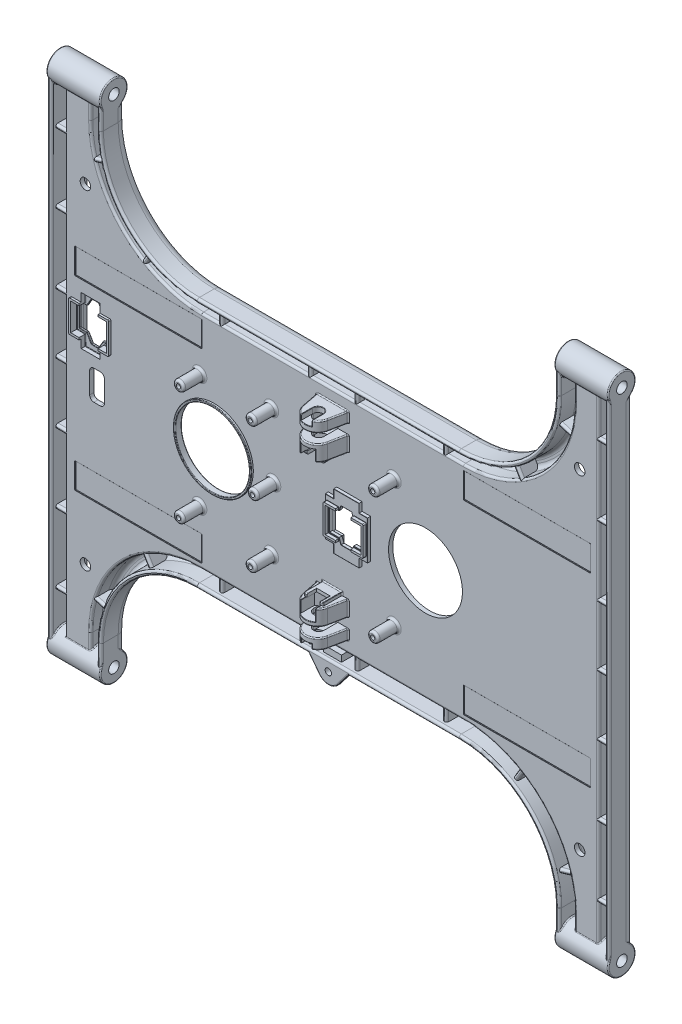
SolidWorks part; units mm, degrees
ref_plane "Face" through (0, 0, 0) normal (0, 0, 1) x (1, 0, 0)
ref_plane "Dessus" through (0, 0, 0) normal (0, 1, 0) x (1, 0, 0)
ref_plane "Droite" through (0, 0, 0) normal (1, 0, 0) x (0, 0, -1)
sketch "Esquisse1" plane through (0, 0, 0) normal (0, 0, 1) x (1, 0, 0)
  line L0 (0, 0) -> (0, 93.6129) construction
  line L1 (0, 55) -> (-62, 55)
  line L2 (0, 55) -> (62, 55)
  line L3 (-62, 55) -> (-62, 105) construction
  line L4 (62, 55) -> (62, 105) construction
  line L5 (-62, 105) -> (-112, 105) construction
  line L6 (62, 105) -> (112, 105) construction
  arc A0 (-112, 105) -> (-62, 55) centre (-62, 105) ccw
  arc A1 (112, 105) -> (62, 55) centre (62, 105) cw
  dimension "D1" = 55
  dimension "D2" = 112
  dimension "D3" = 62
ref_plane "Plan1" through (0, 105, 0) normal (0, 1, 0) x (-1, 0, 0)
sketch "Esquisse2" plane through (0, 105, 0) normal (0, 1, 0) x (-1, 0, 0)
  line L0 (-116.5, 0) -> (-116.5, -6)
  line L1 (-112.5, -10) -> (-111.5, -10)
  line L2 (-107.5, -6) -> (-107.5, 2)
  line L5 (-116.5, 0) -> (-114.5, 0)
  line L6 (-114.5, 0) -> (-114.5, -6)
  line L7 (-112.5, -8) -> (-111.5, -8)
  line L8 (-109.5, -6) -> (-109.5, 2)
  line L9 (-109.5, 2) -> (-107.5, 2)
  line L10 (-112, -8) -> (-112, 7.5979) construction
  line L11 (-62, 0) -> (-112, 0) construction
  arc A0 (-114.5, -6) -> (-112.5, -8) centre (-112.5, -6) ccw
  arc A1 (-109.5, -6) -> (-111.5, -8) centre (-111.5, -6) cw
  arc A2 (-112.5, -10) -> (-116.5, -6) centre (-112.5, -6) cw
  arc A3 (-107.5, -6) -> (-111.5, -10) centre (-111.5, -6) cw
  point P18 (-116.5, -10)
  point P21 (-107.5, -10)
  dimension "D7" = 2
  dimension "D8" = 4
  dimension "D1" = 2
  dimension "D2" = 10
  dimension "D3" = 9
  dimension "D4" = 2
  dimension "D5" = 2
  dimension "D6" = 2
sweep "Balayage1" add profiles "Esquisse2" path "Esquisse1"
sketch "Esquisse3" plane through (0, 0, 0) normal (0, 0, 1) x (1, 0, 0)
  line L0 (62, 50.5) -> (-62, 50.5) construction
  line L1 (62, 50.5) -> (-62, 50.5)
  line L2 (-116.5, 105) -> (-124, 105)
  line L3 (12.925, 105) -> (-12.925, 105) construction
  line L4 (-124, 105) -> (-124, 0)
  line L5 (-124, 0) -> (124, 0)
  line L6 (124, 0) -> (124, 105)
  line L7 (116.5, 105) -> (124, 105)
  arc A0 (-116.5, 105) -> (-62, 50.5) centre (-62, 105) ccw construction
  arc A1 (62, 50.5) -> (116.5, 105) centre (62, 105) ccw construction
  arc A2 (-116.5, 105) -> (-62, 50.5) centre (-62, 105) ccw
  arc A3 (62, 50.5) -> (116.5, 105) centre (62, 105) ccw
  dimension "D1" = 124
  dimension "D2" = 124
extrude "Extrusion1" add sketch "Esquisse3" against normal blind 2
mirror "Symétrie3" about plane through (0, 0, 0) normal (0, 1, 0) of "Extrusion1"
mirror "Symétrie4" about plane through (0, 0, 0) normal (0, 1, 0) of "Balayage1"
sketch "Esquisse4" plane through (0, 0, 0) normal (0, 1, 0) x (1, 0, 0)
  line L0 (133, -2) -> (133, 6)
  line L1 (129, 10) -> (128, 10)
  line L2 (124, 6) -> (124, 0)
  line L3 (124, 0) -> (126, 0)
  line L4 (126, 0) -> (126, 6)
  line L5 (128, 8) -> (129, 8)
  line L6 (131, 6) -> (131, -2)
  line L7 (131, -2) -> (133, -2)
  line L8 (114.5, 0) -> (124, 0) construction
  line L9 (124, 2) -> (124, 0) construction
  arc A0 (126, 6) -> (128, 8) centre (128, 6) cw
  arc A1 (131, 6) -> (129, 8) centre (129, 6) ccw
  arc A2 (124, 6) -> (128, 10) centre (128, 6) cw
  arc A3 (133, 6) -> (129, 10) centre (129, 6) ccw
  point P16 (124, 10)
  point P19 (133, 10)
  dimension "D7" = 2
  dimension "D8" = 4
  dimension "D1" = 2
  dimension "D2" = 2
  dimension "D3" = 2
  dimension "D4" = 10
  dimension "D5" = 12
  dimension "D6" = 9
extrude "Extrusion2" add sketch "Esquisse4" along normal mid plane 210
mirror "Symétrie5" about plane through (0, 0, 0) normal (1, 0, 0) of "Extrusion2"
sketch "Esquisse6" plane through (0, 105, 0) normal (0, 1, 0) x (-1, 0, 0)
  line L0 (0, 0) -> (0, -121.7438) construction
  line L1 (114.5, -6) -> (114.5, 0)
  line L2 (111.5, -8) -> (112.5, -8)
  line L3 (109.5, 2) -> (109.5, -6)
  line L4 (107.5, 2) -> (109.5, 2)
  line L5 (107.5, -6) -> (107.5, 2)
  line L6 (112.5, -10) -> (111.5, -10)
  line L7 (116.5, -2) -> (116.5, -6)
  line L8 (124, -2) -> (116.5, -2)
  line L9 (124, -6) -> (124, -2)
  line L10 (129, -10) -> (128, -10)
  line L11 (133, 2) -> (133, -6)
  line L12 (131, 2) -> (133, 2)
  line L13 (131, -6) -> (131, 2)
  line L14 (128, -8) -> (129, -8)
  line L15 (126, 0) -> (126, -6)
  line L16 (-114.5, 0) -> (-126, 0)
  line L17 (-126, 0) -> (-126, -6)
  line L18 (-128, -8) -> (-129, -8)
  line L19 (-131, -6) -> (-131, 2)
  line L20 (-131, 2) -> (-133, 2)
  line L21 (-133, 2) -> (-133, -6)
  line L22 (-129, -10) -> (-128, -10)
  line L23 (-124, -6) -> (-124, -2)
  line L24 (-124, -2) -> (-116.5, -2)
  line L25 (-116.5, -2) -> (-116.5, -6)
  line L26 (-112.5, -10) -> (-111.5, -10)
  line L27 (-107.5, -6) -> (-107.5, 2)
  line L28 (-107.5, 2) -> (-109.5, 2)
  line L29 (-109.5, 2) -> (-109.5, -6)
  line L30 (-111.5, -8) -> (-112.5, -8)
  line L31 (-114.5, -6) -> (-114.5, 0)
  line L32 (-114.5, 0) -> (-126, 0)
  line L33 (-126, 0) -> (-126, -6)
  line L34 (-128, -8) -> (-129, -8)
  line L35 (-131, -6) -> (-131, 2)
  line L36 (-131, 2) -> (-133, 2)
  line L37 (-133, 2) -> (-133, -6)
  line L38 (-129, -10) -> (-128, -10)
  line L39 (-124, -6) -> (-124, -2)
  line L40 (-124, -2) -> (-116.5, -2)
  line L41 (-116.5, -2) -> (-116.5, -6)
  line L42 (-112.5, -10) -> (-111.5, -10)
  line L43 (-107.5, -6) -> (-107.5, 2)
  line L44 (-107.5, 2) -> (-109.5, 2)
  line L45 (-109.5, 2) -> (-109.5, -6)
  line L46 (-111.5, -8) -> (-112.5, -8)
  line L47 (-114.5, -6) -> (-114.5, 0)
  line L48 (114.5, 0) -> (126, 0)
  arc A0 (114.5, -6) -> (112.5, -8) centre (112.5, -6) cw
  arc A1 (111.5, -8) -> (109.5, -6) centre (111.5, -6) cw
  arc A2 (111.5, -10) -> (107.5, -6) centre (111.5, -6) cw
  arc A3 (116.5, -6) -> (112.5, -10) centre (112.5, -6) cw
  arc A4 (128, -10) -> (124, -6) centre (128, -6) cw
  arc A5 (133, -6) -> (129, -10) centre (129, -6) cw
  arc A6 (131, -6) -> (129, -8) centre (129, -6) cw
  arc A7 (128, -8) -> (126, -6) centre (128, -6) cw
  arc A8 (-128, -8) -> (-126, -6) centre (-128, -6) ccw
  arc A9 (-131, -6) -> (-129, -8) centre (-129, -6) ccw
  arc A10 (-133, -6) -> (-129, -10) centre (-129, -6) ccw
  arc A11 (-128, -10) -> (-124, -6) centre (-128, -6) ccw
  arc A12 (-116.5, -6) -> (-112.5, -10) centre (-112.5, -6) ccw
  arc A13 (-111.5, -10) -> (-107.5, -6) centre (-111.5, -6) ccw
  arc A14 (-111.5, -8) -> (-109.5, -6) centre (-111.5, -6) ccw
  arc A15 (-114.5, -6) -> (-112.5, -8) centre (-112.5, -6) ccw
  arc A16 (-128, -8) -> (-126, -6) centre (-128, -6) ccw
  arc A17 (-131, -6) -> (-129, -8) centre (-129, -6) ccw
  arc A18 (-133, -6) -> (-129, -10) centre (-129, -6) ccw
  arc A19 (-128, -10) -> (-124, -6) centre (-128, -6) ccw
  arc A20 (-116.5, -6) -> (-112.5, -10) centre (-112.5, -6) ccw
  arc A21 (-111.5, -10) -> (-107.5, -6) centre (-111.5, -6) ccw
  arc A22 (-111.5, -8) -> (-109.5, -6) centre (-111.5, -6) ccw
  arc A23 (-114.5, -6) -> (-112.5, -8) centre (-112.5, -6) ccw
  dimension "D1" = 0
extrude "Extrusion3" add sketch "Esquisse6" along normal blind 10
mirror "Symétrie6" about plane through (0, 0, 0) normal (0, 1, 0) of "Extrusion3"
sketch "Esquisse5" plane through (133, 0, 0) normal (1, 0, 0) x (0, 0, -1)
  line L0 (0, 115) -> (0, -115) construction
  circle A0 centre (4, 117.5) radius 6.5
  dimension "D3" = 13
  dimension "D1" = 117.5
  dimension "D2" = 4
extrude "Extrusion4" add sketch "Esquisse5" against normal up to surface (25.5 mm away)
sketch "Esquisse7" plane through (133, 0, 0) normal (1, 0, 0) x (0, 0, -1)
  circle A0 centre (4, 117.5) radius 2.5
  dimension "D1" = 5
extrude "Enlèv. mat.-Extru.1" cut sketch "Esquisse7" against normal blind 40
mirror "Symétrie8" about plane through (0, 0, 0) normal (0, 1, 0) of "Enlèv. mat.-Extru.1", "Extrusion4"
sketch "Esquisse8" plane through (-133, 0, 0) normal (-1, 0, 0) x (0, 0, 1)
  circle A0 centre (-4, 117.5) radius 6.5
  circle A1 centre (-4, -117.5) radius 6.5
extrude "Extrusion5" add sketch "Esquisse8" against normal up to surface (25.5 mm away)
sketch "Esquisse9" plane through (-133, 0, 0) normal (-1, 0, 0) x (0, 0, 1)
  circle A0 centre (-4, 117.5) radius 2.5 construction
  circle A1 centre (-4, 117.5) radius 2.5
  circle A2 centre (-4, -117.5) radius 2.5 construction
  circle A3 centre (-4, -117.5) radius 2.5
extrude "Enlèv. mat.-Extru.2" cut sketch "Esquisse9" against normal blind 40
sketch "Esquisse10" plane through (0, 0, 0) normal (0, 0, 1) x (1, 0, 0)
  line L0 (-29, 30) -> (29, 30) construction
  line L1 (0, 0) -> (67.6607, 0) construction
  circle A0 centre (-63, 27) radius 2.5
  circle A1 centre (-29, 30) radius 2.5
  circle A2 centre (29, 30) radius 2.5
  circle A3 centre (29, -30) radius 2.5
  circle A4 centre (-29, -30) radius 2.5
  circle A5 centre (-63, -27) radius 2.5
  circle A6 centre (-28, 0) radius 2.5
  dimension "D2" = 5
  dimension "D3" = 5
  dimension "D4" = 5
  dimension "D9" = 5
  dimension "D1" = 30
  dimension "D5" = 58
  dimension "D6" = 27
  dimension "D7" = 34
  dimension "D8" = 29
  dimension "D10" = 35
extrude "Extrusion6" add sketch "Esquisse10" along normal blind 10
sketch "Esquisse11" plane through (0, 0, 10) normal (0, 0, 1) x (1, 0, 0)
  line L0 (0, 0) -> (51.2219, 0) construction
  circle A8 centre (-63, 27) radius 1
  circle A9 centre (-29, 30) radius 1
  circle A10 centre (29, 30) radius 1
  circle A11 centre (29, -30) radius 1
  circle A12 centre (-29, -30) radius 1
  circle A13 centre (-63, -27) radius 1
  circle A14 centre (-28, 0) radius 1
  dimension "D1" = 2
extrude "Enlèv. mat.-Extru.3" cut sketch "Esquisse11" against normal blind 8
fillet "Congé1" radius 1 14 edges at (-60.5, 27, 0) (-60.5, 27, 10) (-26.5, 30, 0) (-26.5, 30, 10) (31.5, 30, 0) (31.5, 30, 10) (26.5, -30, 0) (26.5, -30, 10) (-31.5, -30, 0) (-31.5, -30, 10) (-65.5, -27, 0) (-65.5, -27, 10) (-25.5, 0, 0) (-25.5, 0, 10)
sketch "Esquisse12" plane through (0, 0, 0) normal (0, 0, 1) x (1, 0, 0)
  line L0 (0, 0) -> (-92.224, 0) construction
  line L1 (-63, 27) -> (-63, -16.4921) construction
  circle A0 centre (-56, 0) radius 17.5
  dimension "D2" = 35
  dimension "D1" = 7
extrude "Enlèv. mat.-Extru.4" cut sketch "Esquisse12" against normal blind 8
sketch "Esquisse13" plane through (0, 0, 0) normal (0, 0, 1) x (1, 0, 0)
  circle A0 centre (-56, 0) radius 17.5 construction
  circle A1 centre (-56, 0) radius 17.5
  circle A2 centre (-56, 0) radius 18.5
  dimension "D1" = 1
extrude "Extrusion7" add sketch "Esquisse13" along normal blind 1
fillet "Congé2" radius 0.25 3 edges at (-38.5, 0, 1) (-37.5, 0, 1) (-38.5, 0, -2)
fillet "Congé3" radius 1 43 edges at (-94.1734, -72.8266, 2) (99.1231, 67.8769, 0) (-99.1231, -67.8769, 0) (0, -59.5, 2) (0, -52.5, 0) (99.1231, -67.8769, 0) (95.5876, -71.4124, 2) (94.1734, -72.8266, 2) (0, -57.5, 2) (-95.5876, -71.4124, 2) (95.5876, 71.4124, 2) (94.1734, 72.8266, 2) (131, 0, 2) (133, 0, 2) (-133, 0, 2) (-131, 0, 2) (107.5, 110, 2) (109.5, 110, 2) (132, 115, 2) (108.5, 115, 2) (-109.5, 110, 2) (-107.5, 110, 2) (-108.5, 115, 2) (-132, 115, 2) (0, 59.5, 2) (0, 57.5, 2) (0, 52.5, 0) (108.5, -115, 2) (109.5, -110, 2) (107.5, -110, 2) (132, -115, 2) (-132, -115, 2) (-108.5, -115, 2) (-107.5, -110, 2) (-109.5, -110, 2) (114.5, 108.6883, 0) (126, 0, 0) (114.5, -108.6883, 0) (-114.5, 108.6883, 0) (-114.5, -108.6883, 0) (-94.1734, 72.8266, 2) (-95.5876, 71.4124, 2) (-99.1231, 67.8769, 0)
fillet "Congé5" radius 0.5 110 edges at (128.5, 115, -10) (112, 115, -10) (-112, 115, -10) (-128.5, 115, -10) (112, -115, -10) (128.5, -115, -10) (-128.5, -115, -10) (-112, -115, -10) (109.4789, 113.9605, -9.4518) (113.8946, 114.467, -9.749) (116.5, 111, -4) (120.25, 111.3153, -2) (124, 111, -4) (131.4842, 111.0001, -4.0352) (131.6401, 113.3527, -9.005) (127.4992, 111.0355, -4.678) (128.5, 112.3765, -8) (126.92, 112.1444, -7.6833) (126, 111.0226, -3.458) (110.9992, 111.0355, -4.678) (110.42, 112.1444, -7.6833) (109.5, 111.2575, -2.1885) (112, 112.3765, -8) (133, 123.7425, -5.8115) (107.5, 123.7425, -5.8115) (131.6401, -113.3527, -9.005) (133, -123.7425, -5.8115) (127.4992, -111.0355, -4.678) (128.5, -112.3765, -8) (126.92, -112.1444, -7.6833) (126, -111.0226, -3.458) (112, -112.3765, -8) (107.5, -123.7425, -5.8115) (120.25, -111.3153, -2) (124, -111, -4) (131.4842, -111.0001, -4.0352) (116.5, -111, -4) (114.5211, -113.9605, -9.4518) (108.8599, -113.3527, -9.005) (109.9687, -111.8921, -7.2865) (113.7338, -112.0708, -7.574) (114.5, -111.0226, -3.458) (-109.9687, 111.8921, -7.2865) (-113.58, 112.1444, -7.6833) (-114.5, 111.0226, -3.458) (-120.25, 111.3153, -2) (-116.5, 111, -4) (-114.5211, 113.9605, -9.4518) (-108.8599, 113.3527, -9.005) (-107.5, 123.7425, -5.8115) (-124, 111, -4) (-131.4842, 111.0001, -4.0352) (-131.6401, 113.3527, -9.005) (-127.4992, 111.0355, -4.678) (-128.5, 112.3765, -8) (-126.92, 112.1444, -7.6833) (-126, 111.0993, -2.868) (-120.75, 112.3765, 0) (-112, 112.3765, -8) (-133, 123.7425, -5.8115) (-112, -112.3765, -8) (-120.25, -111.3153, -2) (-107.5, -123.7425, -5.8115) (-131.0867, -111.0228, -3.4559) (-124, -111, -4) (-116.5, -111, -4) (-114.5211, -113.9605, -9.4518) (-108.8599, -113.3527, -9.005) (-109.9687, -111.8921, -7.2865) (-113.7338, -112.0708, -7.574) (-114.5, -111.0226, -3.458) (-126, -111.0993, -2.868) (-129.5008, -111.0355, -4.678) (-128.5, -112.3765, -8) (-130.08, -112.1444, -7.6833) (-131, -111.2575, -2.1885) (-131.0211, -113.9605, -9.4518) (-133, -123.7425, -5.8115) (-120.75, -112.3765, 0) (120.25, -112.3765, 0) (120.25, 112.3765, 0) (114.5, 111.0226, -3.458) (-109.5, -111.2575, -2.1885) (109.5, -111.2575, -2.1885) (-109.5, 111.2575, -2.1885) (131, -111.2575, -2.1885) (131, 111.2575, -2.1885) (-131, 111.2575, -2.1885) (-114.9663, 112.2597, -0.1543) (114.8301, 112.1855, -0.2575) (-108.0255, -114.7301, 1.8803) (107.9646, -114.6556, 1.8446) (-109.0354, -114.6556, 1.8446) (108.9745, -114.7301, 1.8803) (-114.8301, -112.1855, -0.2575) (114.9663, -112.2597, -0.1543) (109.0354, 114.6556, 1.8446) (-108.9745, 114.7301, 1.8803) (108.0255, 114.7301, 1.8803) (-107.9646, 114.6556, 1.8446) (125.6699, -112.1855, -0.2575) (125.5337, 112.2597, -0.1543) (132.4745, -114.7301, 1.8803) (132.5354, 114.6556, 1.8446) (131.4646, -114.6556, 1.8446) (131.5255, 114.7301, 1.8803) (-131.5255, -114.7301, 1.8803) (-131.4646, 114.6556, 1.8446) (-132.5354, -114.6556, 1.8446) (-132.4745, 114.7301, 1.8803)
sketch "Esquisse14" plane through (0, 0, 0) normal (0, 0, 1) x (1, 0, 0)
  line L0 (-54, -51.7682) -> (-54, -57.9534)
  line L1 (-12, -51.7682) -> (-10, -51.7682)
  line L2 (-12, -51.7682) -> (-12, -57.9534)
  line L3 (-12, -57.9534) -> (-10, -57.9534)
  line L4 (-10, -51.7682) -> (-10, -57.9534)
  line L5 (-54, -51.7682) -> (-52, -51.7682)
  line L6 (-52, -51.7682) -> (-52, -57.9534)
  line L7 (-54, -57.9534) -> (-52, -57.9534)
  line L8 (0, 0) -> (0, -116.2381) construction
  line L9 (54, -57.9534) -> (52, -57.9534)
  line L10 (52, -51.7682) -> (52, -57.9534)
  line L11 (54, -51.7682) -> (52, -51.7682)
  line L12 (10, -51.7682) -> (10, -57.9534)
  line L13 (12, -57.9534) -> (10, -57.9534)
  line L14 (12, -51.7682) -> (12, -57.9534)
  line L15 (12, -51.7682) -> (10, -51.7682)
  line L16 (54, -51.7682) -> (54, -57.9534)
  line L17 (-62, -105) -> (-91.9202, -55.2638) construction
  line L18 (-87.1923, -65.063) -> (-90.1732, -60.1079)
  line L19 (-85.4785, -64.032) -> (-88.4594, -59.0769)
  line L20 (-90.1732, -60.1079) -> (-89.3163, -59.5924)
  line L21 (-88.4594, -59.0769) -> (-89.3163, -59.5924)
  line L22 (-87.1923, -65.063) -> (-86.3354, -64.5475)
  line L23 (-85.4785, -64.032) -> (-86.3354, -64.5475)
  line L24 (-62, -105) -> (-119.5283, -87.9238) construction
  line L25 (-112.4313, -88.9873) -> (-106.5973, -90.719)
  line L26 (-113.0005, -90.9046) -> (-107.1664, -92.6363)
  line L27 (-106.5973, -90.719) -> (-107.1664, -92.6363)
  line L28 (-112.4313, -88.9873) -> (-113.0005, -90.9046)
  line L29 (112.4313, -88.9873) -> (113.0005, -90.9046)
  line L30 (106.5973, -90.719) -> (107.1664, -92.6363)
  line L31 (113.0005, -90.9046) -> (107.1664, -92.6363)
  line L32 (112.4313, -88.9873) -> (106.5973, -90.719)
  line L33 (85.4785, -64.032) -> (86.3354, -64.5475)
  line L34 (87.1923, -65.063) -> (86.3354, -64.5475)
  line L35 (88.4594, -59.0769) -> (89.3163, -59.5924)
  line L36 (90.1732, -60.1079) -> (89.3163, -59.5924)
  line L37 (85.4785, -64.032) -> (88.4594, -59.0769)
  line L38 (87.1923, -65.063) -> (90.1732, -60.1079)
  line L39 (-131.4555, -93.5) -> (-131.4555, -95.5)
  line L40 (123.9474, -27.5) -> (131.4555, -27.5)
  line L41 (123.9474, -27.5) -> (123.9474, -29.5)
  line L42 (123.9474, -29.5) -> (131.4555, -29.5)
  line L43 (131.4555, -27.5) -> (131.4555, -29.5)
  line L44 (123.9474, -60.5) -> (131.4555, -60.5)
  line L45 (123.9474, -60.5) -> (123.9474, -62.5)
  line L46 (123.9474, -62.5) -> (131.4555, -62.5)
  line L47 (131.4555, -60.5) -> (131.4555, -62.5)
  line L48 (123.9474, -93.5) -> (131.4555, -93.5)
  line L49 (123.9474, -93.5) -> (123.9474, -95.5)
  line L50 (123.9474, -95.5) -> (131.4555, -95.5)
  line L51 (131.4555, -93.5) -> (131.4555, -95.5)
  line L52 (-123.9474, -95.5) -> (-131.4555, -95.5)
  line L53 (-123.9474, -93.5) -> (-123.9474, -95.5)
  line L54 (-123.9474, -93.5) -> (-131.4555, -93.5)
  line L55 (-131.4555, -60.5) -> (-131.4555, -62.5)
  line L56 (-123.9474, -62.5) -> (-131.4555, -62.5)
  line L57 (-123.9474, -60.5) -> (-123.9474, -62.5)
  line L58 (-123.9474, -60.5) -> (-131.4555, -60.5)
  line L59 (-131.4555, -27.5) -> (-131.4555, -29.5)
  line L60 (-123.9474, -29.5) -> (-131.4555, -29.5)
  line L61 (-123.9474, -27.5) -> (-123.9474, -29.5)
  line L62 (-123.9474, -27.5) -> (-131.4555, -27.5)
  dimension "D1" = 2
  dimension "D2" = 10
  dimension "D3" = 40
  dimension "D4" = 2
  dimension "D5" = 2
  dimension "D6" = 2
  dimension "D7" = 27.5
  dimension "D8" = 2
  dimension "D9" = 31
  dimension "D10" = 2
  dimension "D11" = 31
extrude "Extrusion8" add sketch "Esquisse14" against normal up to body separate body
mirror "Symétrie9" about plane through (0, 0, 0) normal (0, 1, 0) of "Extrusion8"
sketch "Esquisse18" plane through (0, 0, 0) normal (0, 0, 1) x (1, 0, 0)
  line L0 (0, 0) -> (0, 111.7019) construction
  line L1 (124.5709, 1) -> (132, 1)
  line L2 (124.5709, 1) -> (124.5709, -1)
  line L3 (124.5709, -1) -> (132, -1)
  line L4 (132, 1) -> (132, -1)
  line L5 (-132, 1) -> (-132, -1)
  line L6 (-124.5709, -1) -> (-132, -1)
  line L7 (-124.5709, 1) -> (-124.5709, -1)
  line L8 (-124.5709, 1) -> (-132, 1)
  dimension "D1" = 1
  dimension "D2" = 1
extrude "Extrusion11" add sketch "Esquisse18" against normal up to body separate body
fillet "Congé6" radius 1 196 edges at (-10, -52.2963, -0.3951) (-12, -52.2963, -0.3951) (-11, -57.5, 0) (-12, -51.7682, -0.0183) (-10, -51.7682, -0.0183) (-12, -54.6341, 0) (-10, -54.6341, 0) (-11, -51.7682, 0) (-54, -52.2963, -0.3951) (-52, -52.2963, -0.3951) (-53, -57.5, 0) (-54, -51.7682, -0.0183) (-52, -51.7682, -0.0183) (-52, -54.6341, 0) (-53, -51.7682, 0) (-54, -54.6341, 0) (52, -52.2963, -0.3951) (54, -52.2963, -0.3951) (53, -57.5, 0) (52, -51.7682, -0.0183) (54, -51.7682, -0.0183) (54, -54.6341, 0) (53, -51.7682, 0) (52, -54.6341, 0) (12, -52.2963, -0.3951) (10, -52.2963, -0.3951) (11, -57.5, 0) (10, -51.7682, -0.0183) (12, -51.7682, -0.0183) (10, -54.6341, 0) (12, -54.6341, 0) (11, -51.7682, 0) (-88.2305, -59.4574, -0.6692) (-90.04, -60.3293, -0.3478) (-86.4858, -64.2975, 0) (-90.1732, -60.1079, -0.0669) (-88.4594, -59.0769, -0.0669) (-88.7552, -62.4649, 0) (-87.0414, -61.4339, 0) (-88.8878, -59.3346, 0) (-89.7447, -59.8501, 0) (-112.0898, -89.0887, -0.6692) (-112.7755, -90.9714, -0.4307) (-107.5363, -91.4834, 0) (-113.0005, -90.9046, -0.0954) (-112.4313, -88.9873, -0.0954) (-110.4056, -91.6748, 0) (-109.8365, -89.7575, 0) (-112.7159, -89.946, 0) (112.2064, -89.0541, -0.4307) (112.659, -91.006, -0.6692) (107.5363, -91.4834, 0) (110.4056, -91.6748, 0) (112.7159, -89.946, 0) (109.8365, -89.7575, 0) (113.0005, -90.9046, -0.0954) (112.4313, -88.9873, -0.0954) (89.9443, -60.4884, -0.6692) (88.3262, -59.2983, -0.3478) (86.4858, -64.2975, 0) (87.0414, -61.4339, 0) (88.7552, -62.4649, 0) (89.7447, -59.8501, 0) (88.8878, -59.3346, 0) (90.1732, -60.1079, -0.0669) (88.4594, -59.0769, -0.0669) (125.7071, -29.5, -0.2929) (125.7071, -27.5, -0.2929) (128, -27.5, 0) (128, -29.5, 0) (131, -28.5, 0) (125.7071, -62.5, -0.2929) (125.7071, -60.5, -0.2929) (128, -60.5, 0) (128, -62.5, 0) (131, -61.5, 0) (125.7071, -95.5, -0.2929) (125.7071, -93.5, -0.2929) (128, -93.5, 0) (128, -95.5, 0) (131, -94.5, 0) (-128.5, -93.5, 0) (-131, -94.5, 0) (-128.5, -95.5, 0) (-131, -61.5, 0) (-128.5, -62.5, 0) (-128.5, -60.5, 0) (-131, -28.5, 0) (-128.5, -29.5, 0) (-128.5, -27.5, 0) (-10, 52.2963, -0.3951) (-12, 52.2963, -0.3951) (-11, 57.5, 0) (-12, 54.6341, 0) (-12, 51.7682, -0.0183) (-10, 54.6341, 0) (-10, 51.7682, -0.0183) (-11, 51.7682, 0) (-53, 57.5, 0) (-52, 54.6341, 0) (-54, 54.6341, 0) (-54, 51.7682, -0.0183) (-52, 52.2963, -0.3951) (-54, 52.2963, -0.3951) (-52, 51.7682, -0.0183) (-53, 51.7682, 0) (53, 57.5, 0) (54, 54.6341, 0) (52, 54.6341, 0) (52, 51.7682, -0.0183) (54, 52.2963, -0.3951) (52, 52.2963, -0.3951) (54, 51.7682, -0.0183) (53, 51.7682, 0) (11, 57.5, 0) (10, 54.6341, 0) (10, 51.7682, -0.0183) (12, 54.6341, 0) (10, 52.2963, -0.3951) (12, 52.2963, -0.3951) (12, 51.7682, -0.0183) (11, 51.7682, 0) (-88.2305, 59.4574, -0.6692) (-90.04, 60.3293, -0.3478) (-86.4858, 64.2975, 0) (-88.7552, 62.4649, 0) (-90.1732, 60.1079, -0.0669) (-87.0414, 61.4339, 0) (-88.4594, 59.0769, -0.0669) (-88.8878, 59.3346, 0) (-89.7447, 59.8501, 0) (-107.5363, 91.4834, 0) (-110.4056, 91.6748, 0) (-113.0005, 90.9046, -0.0954) (-109.8365, 89.7575, 0) (-112.7755, 90.9714, -0.4307) (-112.0898, 89.0887, -0.6692) (-112.4313, 88.9873, -0.0954) (-112.7159, 89.946, 0) (112.2064, 89.0541, -0.4307) (112.659, 91.006, -0.6692) (107.5363, 91.4834, 0) (110.4056, 91.6748, 0) (113.0005, 90.9046, -0.0954) (112.7159, 89.946, 0) (112.4313, 88.9873, -0.0954) (109.8365, 89.7575, 0) (86.4858, 64.2975, 0) (88.3262, 59.2983, -0.3478) (89.9443, 60.4884, -0.6692) (90.1732, 60.1079, -0.0669) (89.7447, 59.8501, 0) (88.8878, 59.3346, 0) (88.4594, 59.0769, -0.0669) (87.0414, 61.4339, 0) (88.7552, 62.4649, 0) (131, 28.5, 0) (125.7071, 29.5, -0.2929) (125.7071, 27.5, -0.2929) (128, 29.5, 0) (128, 27.5, 0) (131, 61.5, 0) (125.7071, 62.5, -0.2929) (125.7071, 60.5, -0.2929) (128, 62.5, 0) (128, 60.5, 0) (131, 94.5, 0) (125.7071, 95.5, -0.2929) (125.7071, 93.5, -0.2929) (128, 95.5, 0) (128, 93.5, 0) (-131, 94.5, 0) (-128.5, 95.5, 0) (-128.5, 93.5, 0) (-131, 61.5, 0) (-128.5, 62.5, 0) (-128.5, 60.5, 0) (-131, 28.5, 0) (-128.5, 29.5, 0) (-128.5, 27.5, 0) (128, 1, 0) (128, -1, 0) (125.7071, 1, -0.2929) (125.7071, -1, -0.2929) (131, 0, 0) (-131, 0, 0) (-128.5, -1, 0) (-128.5, 1, 0)
sketch "Esquisse15" plane through (0, 0, 0) normal (0, 0, 1) x (1, 0, 0)
  line L0 (0, 0) -> (0, -117.9463) construction
  line L1 (0, -58.5) -> (-10, -58.5)
  line L2 (62, -58.5) -> (-62, -58.5) construction
  line L3 (0, -58.5) -> (10, -58.5)
  line L4 (10, -58.5) -> (4.364, -65.8475)
  line L5 (-10, -58.5) -> (-4.364, -65.8475)
  line L7 (-62, -57.5) -> (62, -57.5) construction
  arc A0 (-4.364, -65.8475) -> (4.364, -65.8475) centre (0, -62.5) ccw
  dimension "D3" = 5.5
  dimension "D1" = 5
  dimension "D2" = 20
extrude "Extrusion9" add sketch "Esquisse15" along normal blind 2
sketch "Esquisse16" plane through (0, 0, 0) normal (0, 0, -1) x (-1, 0, 0)
  line L0 (0, -62.5) -> (0, -51.8499) construction
  line L2 (-4.25, -54.5513) -> (4.25, -54.5513)
  line L3 (4.25, -62.5) -> (4.25, -54.5513)
  line L4 (-4.25, -62.5) -> (-4.25, -54.5513)
  arc A0 (-4.25, -62.5) -> (4.25, -62.5) centre (0, -62.5) ccw
  dimension "D1" = 8.5
extrude "Extrusion10" add sketch "Esquisse16" along normal blind 10
fillet "Congé7" radius 0.5 9 edges at (4.25, -59, -10) (-4.25, -59, -10) (6.7985, -62.6737, 0) (0, -68, 0) (7.182, -62.1737, 2) (0, -68, 2) (0, -66.75, -10) (-6.7985, -62.6737, 0) (-7.182, -62.1737, 2)
sketch "Esquisse17" plane through (0, 0, 2) normal (0, 0, 1) x (1, 0, 0)
  circle A0 centre (0, -62.5) radius 1.5
  dimension "D1" = 3
extrude "Enlèv. mat.-Extru.5" cut sketch "Esquisse17" against normal blind 10
ref_plane "Plan2" through (0, 47, 0) normal (0, 1, 0) x (-1, 0, 0)
sketch "Esquisse19" plane through (0, 47, 0) normal (0, 1, 0) x (-1, 0, 0)
  line L0 (62, 0) -> (-62, 0) construction
  line L1 (7.5, 0) -> (-7.5, 0)
  line L2 (0, 0) -> (0, 46.8261) construction
  line L3 (7.5, 0) -> (5.8861, 8.1637)
  line L4 (-7.5, 0) -> (-5.8861, 8.1637)
  arc A0 (5.8861, 8.1637) -> (-5.8861, 8.1637) centre (0, 7) ccw
  dimension "D1" = 12
  dimension "D2" = 7
  dimension "D3" = 15
extrude "Extrusion12" add sketch "Esquisse19" against normal blind 17
sketch "Esquisse20" plane through (0, 0, 0) normal (0, 0, 1) x (1, 0, 0)
  line L0 (5.8861, 47) -> (-5.8861, 47) construction
  line L1 (-14.9547, 42) -> (11.543, 42)
  line L2 (-14.9547, 42) -> (-14.9547, 37.5)
  line L3 (-14.9547, 37.5) -> (11.543, 37.5)
  line L4 (11.543, 42) -> (11.543, 37.5)
  dimension "D1" = 4.5
  dimension "D2" = 5
extrude "Enlèv. mat.-Extru.6" cut sketch "Esquisse20" along normal blind 17
sketch "Esquisse21" plane through (0, 47, 0) normal (0, 1, 0) x (-1, 0, 0)
  line L0 (0, 7) -> (0, 19.9837) construction
  line L1 (-2.5, 7) -> (-2.5, 16.6615)
  line L2 (2.5, 7) -> (2.5, 16.6615)
  line L3 (-2.5, 16.6615) -> (2.5, 16.6615)
  arc A0 (-2.5, 7) -> (2.5, 7) centre (0, 7) ccw
  point P9 (0, 16.6615)
  dimension "D1" = 5
extrude "Enlèv. mat.-Extru.7" cut sketch "Esquisse21" against normal blind 2.5
sketch "Esquisse22" plane through (0, 30, 0) normal (0, -1, 0) x (1, 0, 0)
  line L0 (2.4705, 12.4678) -> (0, 11.0415)
  line L1 (3.5, 9.0207) -> (1.75, 10.0311)
  line L2 (-3.5, 11.8734) -> (-3.5, 4.9793)
  line L3 (-3.5, 4.9793) -> (0, 2.9585)
  line L4 (0, 2.9585) -> (3.5, 4.9793)
  line L5 (3.5, 4.9793) -> (3.5, 11.8734)
  circle A0 centre (0, 7) radius 3.5 construction
  arc A1 (5.8861, 8.1637) -> (-5.8861, 8.1637) centre (0, 7) ccw construction
  arc A2 (3.5, 11.8734) -> (-3.5, 11.8734) centre (0, 7) ccw
  dimension "D1" = 7
extrude "Enlèv. mat.-Extru.8" cut sketch "Esquisse22" against normal blind 5.5
sketch "Esquisse23" plane through (0, 0, -2) normal (0, 0, -1) x (-1, 0, 0)
  line L0 (0, 0) -> (0, 72.525) construction
  line L1 (2.5, 44.5) -> (-2.5, 44.5) construction
  line L2 (-2.5, 44.5) -> (2.5, 44.5)
  line L3 (-2.5, 44.5) -> (-2.5, 35.5)
  line L4 (-2.5, 35.5) -> (2.5, 35.5)
  line L5 (2.5, 44.5) -> (2.5, 35.5)
  line L6 (3.5, 35.5) -> (0, 35.5) construction
  dimension "D1" = 2.5
  dimension "D2" = 5
extrude "Enlèv. mat.-Extru.9" cut sketch "Esquisse23" against normal blind 11
sketch "Esquisse24" plane through (0, 30, 0) normal (0, -1, 0) x (1, 0, 0)
  line L0 (4.5, 0) -> (-4.5, 0)
  line L2 (0, 0) -> (0, 18.1642) construction
  line L3 (4.5, 0) -> (4.5, 9)
  line L4 (-4.5, 0) -> (-4.5, 9)
  line L5 (4.5, 9) -> (3, 9)
  line L6 (-4.5, 9) -> (-3, 9)
  line L7 (3, 9) -> (3, 4.5)
  line L8 (-3, 9) -> (-3, 4.5)
  line L9 (3, 4.5) -> (-3, 4.5)
  line L10 (7.5, 0) -> (-7.5, 0) construction
  arc A0 (-2.5, 7) -> (2.5, 7) centre (0, 7) ccw construction
  point P16 (0, 4.5)
  dimension "D1" = 6
  dimension "D2" = 1.5
  dimension "D3" = 9
extrude "Extrusion13" add sketch "Esquisse24" along normal blind 1.5
mirror "Symétrie11" about plane through (0, 0, 0) normal (0, 1, 0) of "Extrusion12", "Enlèv. mat.-Extru.6", "Enlèv. mat.-Extru.7", "Enlèv. mat.-Extru.8", "Enlèv. mat.-Extru.9", "Extrusion13"
fillet "Congé8" radius 2.5 8 edges at (2.5, 36.5, 9) (-2.5, 36.5, 9) (-2.5, 43.25, 9) (2.5, 43.25, 9) (2.5, -43.25, 9) (2.5, -36.5, 9) (-2.5, -36.5, 9) (-2.5, -43.25, 9)
fillet "Congé9" radius 0.75 12 edges at (-7.5, -44.5, 0) (-7.5, -33.75, 0) (7.5, -33.75, 0) (7.5, -44.5, 0) (4.5, -29.25, 0) (-4.5, -29.25, 0) (7.5, 44.5, 0) (7.5, 33.75, 0) (4.5, 29.25, 0) (-4.5, 29.25, 0) (-7.5, 33.75, 0) (-7.5, 44.5, 0)
fillet "Congé10" radius 0.5 48 edges at (-7.6401, -37.5, 0.1705) (-6.6333, -37.5, 4.3841) (7.6401, -37.5, 0.1705) (6.6333, -37.5, 4.3841) (7.6401, -42, 0.1705) (6.6333, -42, 4.3841) (-7.6401, -42, 0.1705) (-6.6333, -42, 4.3841) (7.6401, -47, 0.1705) (6.6333, -47, 4.3841) (-7.6401, -47, 0.1705) (-6.6333, -47, 4.3841) (0, -37.5, 13) (0, -42, 13) (4.71, -47, 10.717) (-4.71, -47, 10.717) (7.6401, -30, 0.1705) (6.6333, -30, 4.3841) (-7.6401, -30, 0.1705) (-5.0463, -30, 10.2457) (5.0463, -30, 10.2457) (-6.6333, -30, 4.3841) (0, -28.5, 0) (0, -47, 0) (7.6401, 47, 0.1705) (6.6333, 47, 4.3841) (-7.6401, 42, 0.1705) (-6.6333, 42, 4.3841) (7.6401, 42, 0.1705) (6.6333, 42, 4.3841) (7.6401, 37.5, 0.1705) (6.6333, 37.5, 4.3841) (-7.6401, 37.5, 0.1705) (-6.6333, 37.5, 4.3841) (7.6401, 30, 0.1705) (6.6333, 30, 4.3841) (4.71, 47, 10.717) (0, 42, 13) (0, 37.5, 13) (5.0463, 30, 10.2457) (0, 28.5, 0) (0, 47, 0) (-7.6401, 47, 0.1705) (-6.6333, 47, 4.3841) (-4.71, 47, 10.717) (-7.6401, 30, 0.1705) (-6.6333, 30, 4.3841) (-5.0463, 30, 10.2457)
fillet "Congé11" radius 0.2 41 edges at (-2.5, -45.5, 12.4544) (-2.5, -46.7906, 12.3517) (-2.5, -47, 9.4495) (0, -47, 4.5) (2.5, -47, 9.4495) (2.5, -46.8657, 12.2789) (2.5, -45.5, 12.4544) (0, -44.5, 13) (4.7512, -28.3922, 0.1899) (-4.7512, -28.3922, 0.1899) (4.5, -28.5, 4.875) (-4.5, -28.5, 4.875) (3.5, -30, 10.1213) (3.5, -30.1267, 11.6658) (-3.5, -30, 10.1213) (-3.5, -30.1371, 11.6799) (3.5, -33, 11.8734) (-3.5, -33, 11.8734) (0, -35.5, 13) (4.5108, -28.5, 0.6232) (-4.5108, -28.5, 0.6232) (2.5, 45.5, 12.4544) (2.5, 46.7906, 12.3517) (2.5, 47, 9.4495) (0, 47, 4.5) (-2.5, 47, 9.4495) (-2.5, 46.8657, 12.2789) (0, 44.5, 13) (-2.5, 45.5, 12.4544) (-4.7512, 28.3922, 0.1899) (-4.5108, 28.5, 0.6232) (4.7512, 28.3922, 0.1899) (4.5108, 28.5, 0.6232) (3.5, 30, 10.1213) (3.5, 30.1371, 11.6799) (-3.5, 30, 10.1213) (-3.5, 30.1267, 11.6658) (-4.5, 28.5, 4.875) (4.5, 28.5, 4.875) (3.5, 33, 11.8734) (-3.5, 33, 11.8734)
fillet "Congé14" radius 0.5 13 edges at (4.5, -29.35, 9) (4.4414, -28.5586, 9) (-3.65, -28.5, 9) (-4.4414, -28.5586, 9) (3.65, -28.5, 9) (-4.5, -29.35, 9) (3.65, 28.5, 9) (4.4414, 28.5586, 9) (-4.5, 29.35, 9) (-4.4414, 28.5586, 9) (4.5, 29.35, 9) (-3.65, 28.5, 9) (3, -28.5, 6.75)
sketch "Esquisse25" plane through (0, 0, 0) normal (0, 0, 1) x (1, 0, 0)
  line L0 (0, 0) -> (187.1087, 0) construction
  line L1 (0, 0) -> (0, 136.2829) construction
  circle A0 centre (117, -78) radius 2.5
  circle A1 centre (117, 78) radius 2.5
  circle A2 centre (-117, -78) radius 2.5
  circle A3 centre (-117, 78) radius 2.5
  dimension "D3" = 5
  dimension "D1" = 78
  dimension "D2" = 117
extrude "Enlèv. mat.-Extru.10" cut sketch "Esquisse25" against normal through all
sketch "Esquisse26" plane through (0, 0, 0) normal (0, 0, 1) x (1, 0, 0)
  line L0 (-123, 21) -> (189.6002, 21) construction
  line L1 (-123, 27.5) -> (-119, 27.5)
  line L2 (-123, 27.5) -> (-123, 14.5)
  line L3 (-123, 14.5) -> (-119, 14.5)
  line L4 (-106, 27.5) -> (-106, 14.5)
  line L6 (-114.5, -14.5) -> (-114.5, -42.8471) construction
  line L7 (-119, 27.5) -> (-119, 32.5)
  line L8 (-119, 32.5) -> (-110, 32.5)
  line L9 (-110, 27.5) -> (-110, 32.5)
  line L10 (-110, 14.5) -> (-110, 9.5)
  line L11 (-119, 9.5) -> (-110, 9.5)
  line L12 (-119, 14.5) -> (-119, 9.5)
  line L13 (-110, 27.5) -> (-106, 27.5)
  line L14 (-110, 14.5) -> (-106, 14.5)
  line L15 (12.5, 6.5) -> (16.5, 6.5)
  line L16 (-113, 4.5) -> (-110, 4.5)
  line L17 (-115, 2.5) -> (-115, -7.5)
  line L18 (-113, -9.5) -> (-110, -9.5)
  line L19 (-108, 2.5) -> (-108, -7.5)
  line L20 (3.5, 6.5) -> (3.5, 10.5)
  line L21 (-0.5, 6.5) -> (-0.5, -6.5)
  line L22 (16.5, 0) -> (-31.1016, 0) construction
  line L23 (16.5, 6.5) -> (16.5, -6.5)
  line L24 (8, 10.5) -> (8, -9.7089) construction
  line L25 (3.5, 6.5) -> (-0.5, 6.5)
  line L26 (3.5, 10.5) -> (12.5, 10.5)
  line L27 (12.5, 6.5) -> (12.5, 10.5)
  line L28 (12.5, -6.5) -> (12.5, -10.5)
  line L29 (3.5, -10.5) -> (12.5, -10.5)
  line L30 (3.5, -6.5) -> (-0.5, -6.5)
  line L31 (3.5, -6.5) -> (3.5, -10.5)
  line L32 (12.5, -6.5) -> (16.5, -6.5)
  line L34 (-133, -112.601) -> (-133, 112.601) construction
  arc A0 (-115, 2.5) -> (-113, 4.5) centre (-113, 2.5) cw
  arc A1 (-108, 2.5) -> (-110, 4.5) centre (-110, 2.5) ccw
  arc A2 (-110, -9.5) -> (-108, -7.5) centre (-110, -7.5) ccw
  arc A3 (-115, -7.5) -> (-113, -9.5) centre (-113, -7.5) ccw
  point P14 (-114.5, 32.5)
  point P19 (-114.5, 9.5)
  point P49 (-0.5, 0)
  dimension "D7" = 2
  dimension "D1" = 17
  dimension "D2" = 13
  dimension "D3" = 5
  dimension "D4" = 10
  dimension "D5" = 9
  dimension "D6" = 5
  dimension "D8" = 4
  dimension "D9" = 7
  dimension "D10" = 14
  dimension "D11" = 2
  dimension "D12" = 9
  dimension "D13" = 13
  dimension "D14" = 17
  dimension "D15" = 4
  dimension "D16" = 21
  dimension "D17" = 8
extrude "Enlèv. mat.-Extru.11" cut sketch "Esquisse26" against normal through all
sketch "Esquisse27" plane through (0, 0, 0) normal (0, 0, 1) x (1, 0, 0)
  line L0 (-110, 9.5) -> (-110, 14.5) construction
  line L1 (-119, 14.5) -> (-119, 9.5) construction
  line L2 (-119, 32.5) -> (-119, 27.5) construction
  line L3 (-110, 27.5) -> (-110, 32.5) construction
  line L4 (-106, 27.5) -> (-110, 27.5) construction
  line L5 (-106, 14.5) -> (-106, 27.5) construction
  line L6 (-110, 14.5) -> (-106, 14.5) construction
  line L7 (-123, 14.5) -> (-119, 14.5) construction
  line L8 (-123, 27.5) -> (-123, 14.5) construction
  line L9 (-119, 27.5) -> (-123, 27.5) construction
  line L10 (-110, 13.5) -> (-110, 14.5)
  line L11 (-119, 14.5) -> (-119, 13.5)
  line L12 (-119, 28.5) -> (-119, 27.5)
  line L13 (-110, 27.5) -> (-110, 28.5)
  line L14 (-106, 27.5) -> (-110, 27.5)
  line L15 (-106, 14.5) -> (-106, 27.5)
  line L16 (-110, 14.5) -> (-106, 14.5)
  line L17 (-123, 14.5) -> (-119, 14.5)
  line L18 (-123, 27.5) -> (-123, 14.5)
  line L19 (-119, 27.5) -> (-123, 27.5)
  line L21 (-123.5, 13.5) -> (-119, 13.5)
  line L22 (-124, 28) -> (-124, 14)
  line L23 (-119, 28.5) -> (-123.5, 28.5)
  line L26 (-105.5, 28.5) -> (-110, 28.5)
  line L27 (-105, 14) -> (-105, 28)
  line L28 (-110, 13.5) -> (-105.5, 13.5)
  arc A0 (-124, 28) -> (-123.5, 28.5) centre (-123.5, 28) cw
  arc A1 (-123.5, 13.5) -> (-124, 14) centre (-123.5, 14) cw
  arc A2 (-105, 14) -> (-105.5, 13.5) centre (-105.5, 14) cw
  arc A3 (-105.5, 28.5) -> (-105, 28) centre (-105.5, 28) cw
  dimension "D2" = 0.5
  dimension "D1" = 1
extrude "Extrusion14" add sketch "Esquisse27" along normal blind 1
sketch "Esquisse28" plane through (0, 0, -2) normal (0, 0, -1) x (-1, 0, 0)
  line L0 (114.5, 32.5) -> (114.5, 9.5) construction
  line L1 (120.5, 29) -> (120.5, 34.5)
  line L2 (110, 32.5) -> (119, 32.5) construction
  line L3 (119, 9.5) -> (110, 9.5) construction
  line L4 (123, 21) -> (105.3523, 21) construction
  line L5 (107, 15.5) -> (107, 26.5)
  line L6 (107, 26.5) -> (110.7268, 26.5)
  line L7 (110.7268, 26.5) -> (112.8919, 30.25)
  line L8 (112.8919, 30.25) -> (116.1081, 30.25)
  line L9 (104.5, 13) -> (104.5, 29)
  line L10 (104.5, 29) -> (108.5, 29)
  line L11 (108.5, 29) -> (108.5, 34.5)
  line L12 (108.5, 34.5) -> (120.5, 34.5)
  line L13 (124.5, 29) -> (120.5, 29)
  line L14 (124.5, 13) -> (124.5, 29)
  line L15 (118.2732, 26.5) -> (116.1081, 30.25)
  line L16 (122, 26.5) -> (118.2732, 26.5)
  line L17 (122, 15.5) -> (122, 26.5)
  line L18 (122, 15.5) -> (118.2732, 15.5)
  line L19 (118.2732, 15.5) -> (116.1081, 11.75)
  line L20 (124.5, 13) -> (120.5, 13)
  line L21 (108.5, 7.5) -> (120.5, 7.5)
  line L22 (108.5, 13) -> (108.5, 7.5)
  line L23 (104.5, 13) -> (108.5, 13)
  line L24 (112.8919, 11.75) -> (116.1081, 11.75)
  line L25 (110.7268, 15.5) -> (112.8919, 11.75)
  line L26 (107, 15.5) -> (110.7268, 15.5)
  line L27 (120.5, 13) -> (120.5, 7.5)
  line L30 (123, 27.5) -> (123, 14.5) construction
  point P8 (114.5, 11.75)
  point P16 (123, 21)
  point P22 (114.5, 34.5)
  point P26 (114.5, 30.25)
  point P30 (122, 21)
  point P33 (124.5, 21)
  point P38 (104.5, 21)
  point P41 (107, 21)
  point P42 (114.5, 7.5)
  dimension "D2" = 11
  dimension "D3" = 10
  dimension "D4" = 16
  dimension "D5" = 6
  dimension "D6" = 27
  dimension "D7" = 18.5
  dimension "D1" = 15
  dimension "D8" = 120
extrude "Extrusion15" add sketch "Esquisse28" along normal blind 1
fillet "Congé15" radius 0.2 50 edges at (-106.5, 29, -3) (-106.5, 13, -3) (-122, 21, -3) (-114.5, 7.5, -3) (-119, 30, -2) (-114.5, 32.5, -2) (-110, 30, -2) (-108, 27.5, -2) (-106, 21, -2) (-108, 14.5, -2) (-110, 12, -2) (-114.5, 9.5, -2) (-119, 12, -2) (-121, 14.5, -2) (-123, 21, -2) (-121, 27.5, -2) (-124, 29, -2.5) (-124, 13, -2.5) (-111.8094, 28.375, -2) (-114.5, 30.25, -2) (-117.1906, 28.375, -2) (-120.1366, 26.5, -2) (-122, 21, -2) (-120.1366, 15.5, -2) (-117.1906, 13.625, -2) (-114.5, 11.75, -2) (-111.8094, 13.625, -2) (-108.8634, 15.5, -2) (-107, 21, -2) (-108.8634, 26.5, -2) (-108.8634, 15.5, -3) (-111.8094, 13.625, -3) (-114.5, 11.75, -3) (-117.1906, 13.625, -3) (-120.1366, 15.5, -3) (-120.1366, 26.5, -3) (-117.1906, 28.375, -3) (-114.5, 30.25, -3) (-111.8094, 28.375, -3) (-108.8634, 26.5, -3) (-107, 21, -3) (-120.5, 10.25, -3) (-108.5, 10.25, -3) (-104.5, 21, -3) (-108.5, 31.75, -3) (-114.5, 34.5, -3) (-120.5, 31.75, -3) (-122.25, 29, -3) (-124, 21, -3) (-122.25, 13, -3)
sketch "Esquisse29" plane through (0, 0, 0) normal (0, 0, 1) x (1, 0, 0)
  line L0 (0, 0) -> (0, 112.3649) construction
  line L1 (62.2, 50) -> (121.8, 50)
  line L2 (62, 49.8) -> (62, 38.2)
  line L3 (62.2, 38) -> (121.8, 38)
  line L4 (122, 49.8) -> (122, 38.2)
  line L5 (0, 0) -> (169.6685, 0) construction
  line L6 (122, -49.8) -> (122, -38.2)
  line L7 (62.2, -38) -> (121.8, -38)
  line L8 (62, -49.8) -> (62, -38.2)
  line L9 (62.2, -50) -> (121.8, -50)
  line L10 (-62.2, -50) -> (-121.8, -50)
  line L11 (-62, -49.8) -> (-62, -38.2)
  line L12 (-62.2, -38) -> (-121.8, -38)
  line L13 (-122, -49.8) -> (-122, -38.2)
  line L14 (-122, 49.8) -> (-122, 38.2)
  line L15 (-62.2, 38) -> (-121.8, 38)
  line L16 (-62, 49.8) -> (-62, 38.2)
  line L17 (-62.2, 50) -> (-121.8, 50)
  arc A0 (-122, 49.8) -> (-121.8, 50) centre (-121.8, 49.8) cw
  arc A1 (-121.8, 38) -> (-122, 38.2) centre (-121.8, 38.2) cw
  arc A2 (-62, 38.2) -> (-62.2, 38) centre (-62.2, 38.2) cw
  arc A3 (-62, 49.8) -> (-62.2, 50) centre (-62.2, 49.8) ccw
  arc A4 (-122, -38.2) -> (-121.8, -38) centre (-121.8, -38.2) cw
  arc A5 (-121.8, -50) -> (-122, -49.8) centre (-121.8, -49.8) cw
  arc A6 (-62, -49.8) -> (-62.2, -50) centre (-62.2, -49.8) cw
  arc A7 (-62.2, -38) -> (-62, -38.2) centre (-62.2, -38.2) cw
  arc A8 (62, -38.2) -> (62.2, -38) centre (62.2, -38.2) cw
  arc A9 (62, -49.8) -> (62.2, -50) centre (62.2, -49.8) ccw
  arc A10 (122, -49.8) -> (121.8, -50) centre (121.8, -49.8) cw
  arc A11 (121.8, -38) -> (122, -38.2) centre (121.8, -38.2) cw
  arc A12 (122, 38.2) -> (121.8, 38) centre (121.8, 38.2) cw
  arc A13 (121.8, 50) -> (122, 49.8) centre (121.8, 49.8) cw
  arc A14 (62, 49.8) -> (62.2, 50) centre (62.2, 49.8) cw
  arc A15 (62.2, 38) -> (62, 38.2) centre (62.2, 38.2) cw
  point P21 (-122, 50)
  point P24 (-122, 38)
  point P27 (-62, 38)
  point P30 (-62, 50)
  point P33 (-122, -38)
  point P36 (-122, -50)
  point P39 (-62, -50)
  point P42 (-62, -38)
  point P45 (62, -38)
  point P48 (62, -50)
  point P51 (122, -50)
  point P54 (122, -38)
  point P57 (122, 38)
  point P60 (122, 50)
  point P63 (62, 50)
  point P66 (62, 38)
  dimension "D5" = 0.2
  dimension "D1" = 12
  dimension "D2" = 100
  dimension "D3" = 244
  dimension "D4" = 60
extrude "Enlèv. mat.-Extru.12" cut sketch "Esquisse29" against normal blind 0.5
sketch "Esquisse30" plane through (0, 0, 0) normal (0, 0, 1) x (1, 0, 0)
  line L1 (12.5, 10.5) -> (3.5, 10.5) construction
  line L5 (-2, -9.25) -> (-2, 9.25)
  line L6 (-2, 9.25) -> (2, 9.25)
  line L7 (2, 9.25) -> (2, 13.25)
  line L8 (2, 13.25) -> (14, 13.25)
  line L9 (0, -5.5) -> (0, 5.5)
  line L10 (0, 5.5) -> (4.5445, 5.5)
  line L11 (4.5445, 5.5) -> (5.5, 8)
  line L12 (5.5, 8) -> (10.5, 8)
  line L13 (5.5, -8) -> (10.5, -8)
  line L14 (4.5445, -5.5) -> (5.5, -8)
  line L15 (0, -5.5) -> (4.5445, -5.5)
  line L16 (2, -13.25) -> (14, -13.25)
  line L17 (2, -9.25) -> (2, -13.25)
  line L18 (-2, -9.25) -> (2, -9.25)
  line L19 (18, -9.25) -> (14, -9.25)
  line L20 (14, -9.25) -> (14, -13.25)
  line L21 (16, -5.5) -> (11.4555, -5.5)
  line L22 (11.4555, -5.5) -> (10.5, -8)
  line L23 (11.4555, 5.5) -> (10.5, 8)
  line L24 (16, 5.5) -> (11.4555, 5.5)
  line L25 (16, -5.5) -> (16, 5.5)
  line L26 (14, 9.25) -> (14, 13.25)
  line L27 (18, 9.25) -> (14, 9.25)
  line L28 (18, -9.25) -> (18, 9.25)
  point P24 (0, 0)
  point P28 (-2, 0)
  point P31 (8, -13.25)
  point P34 (8, -8)
  point P35 (8, 8)
  point P38 (8, 13.25)
  point P40 (18, 0)
  point P41 (16, 0)
  dimension "D1" = 6
  dimension "D4" = 26.5
  dimension "D7" = 2.5
  dimension "D8" = 2.5
extrude "Extrusion16" add sketch "Esquisse30" along normal blind 1.5
sketch "Esquisse31" plane through (0, 0, 1.5) normal (0, 0, 1) x (1, 0, 0)
  line L0 (-1, 7) -> (4.3563, 7)
  line L1 (-0.5, 6) -> (4.3563, 6)
  line L2 (-0.5, 6) -> (-0.5, -6)
  line L3 (4.3563, 7) -> (4.3563, 6)
  line L4 (17.5, 6.5) -> (17.5, -6.5)
  line L5 (11.6437, 7) -> (11.6437, 6)
  line L6 (16.5, 6) -> (16.5, -6)
  line L7 (-1.5, 6.5) -> (-1.5, -6.5)
  line L8 (8, 8) -> (8, -7.3459) construction
  line L9 (10.5, 8) -> (5.5, 8) construction
  line L10 (16, 0) -> (-8.3825, 0) construction
  line L11 (16, -5.5) -> (16, 5.5) construction
  line L12 (16.5, 6) -> (11.6437, 6)
  line L13 (17, 7) -> (11.6437, 7)
  line L14 (17, -7) -> (11.6437, -7)
  line L15 (16.5, -6) -> (11.6437, -6)
  line L16 (11.6437, -7) -> (11.6437, -6)
  line L17 (4.3563, -7) -> (4.3563, -6)
  line L18 (-0.5, -6) -> (4.3563, -6)
  line L19 (-1, -7) -> (4.3563, -7)
  arc A0 (-1.5, 6.5) -> (-1, 7) centre (-1, 6.5) cw
  arc A1 (17.5, 6.5) -> (17, 7) centre (17, 6.5) ccw
  arc A2 (17.5, -6.5) -> (17, -7) centre (17, -6.5) cw
  arc A3 (-1.5, -6.5) -> (-1, -7) centre (-1, -6.5) ccw
  point P2 (16.5, 0)
  point P23 (17.5, 0)
  point P33 (-1.5, 0)
  point P36 (-0.5, 0)
  dimension "D5" = 0.5
  dimension "D2" = 12
  dimension "D3" = 17
  dimension "D4" = 1
  dimension "D1" = 1
extrude "Extrusion17" add sketch "Esquisse31" along normal blind 1.5
fillet "Congé16" radius 0.1 100 edges at (121.9414, -38.0586, 0) (122, -44, 0) (121.9414, -49.9414, 0) (92, -50, 0) (62.0586, -49.9414, 0) (62, -44, 0) (62.0586, -38.0586, 0) (-62.0586, -38.0586, 0) (-62, -44, 0) (-62.0586, -49.9414, 0) (-92, -50, 0) (-121.9414, -49.9414, 0) (-122, -44, 0) (-121.9414, -38.0586, 0) (-62.0586, 49.9414, 0) (-62, 44, 0) (-62.0586, 38.0586, 0) (-92, 38, 0) (-121.9414, 38.0586, 0) (-122, 44, 0) (-121.9414, 49.9414, 0) (121.9414, 49.9414, 0) (122, 44, 0) (121.9414, 38.0586, 0) (92, 38, 0) (62.0586, 38.0586, 0) (62, 44, 0) (62.0586, 49.9414, 0) (92, -38, 0) (-92, -38, 0) (-92, 50, 0) (92, 50, 0) (1.5, -6.5, 0) (3.5, -8.5, 0) (8, -10.5, 0) (12.5, -8.5, 0) (14.5, -6.5, 0) (16.5, 0, 0) (14.5, 6.5, 0) (12.5, 8.5, 0) (8, 10.5, 0) (3.5, 8.5, 0) (1.5, 6.5, 0) (-0.5, 0, 0) (5.0223, 6.75, 0) (8, 8, 0) (10.9777, 6.75, 0) (13.7277, 5.5, 0) (16, 0, 0) (13.7277, -5.5, 0) (10.9777, -6.75, 0) (8, -8, 0) (5.0223, -6.75, 0) (2.2723, -5.5, 0) (0, 0, 0) (2.2723, 5.5, 0) (11.6437, 6.5, 1.5) (14.0718, 6, 1.5) (16.5, 0, 1.5) (14.0718, -6, 1.5) (11.6437, -6.5, 1.5) (14.3218, -7, 1.5) (17.3536, -6.8536, 1.5) (17.5, 0, 1.5) (17.3536, 6.8536, 1.5) (14.3218, 7, 1.5) (2.2723, -5.5, 1.5) (5.0223, -6.75, 1.5) (8, -8, 1.5) (10.9777, -6.75, 1.5) (13.7277, -5.5, 1.5) (16, 0, 1.5) (13.7277, 5.5, 1.5) (10.9777, 6.75, 1.5) (8, 8, 1.5) (5.0223, 6.75, 1.5) (2.2723, 5.5, 1.5) (0, 0, 1.5) (16, -9.25, 1.5) (14, -11.25, 1.5) (8, -13.25, 1.5) (2, -11.25, 1.5) (0, -9.25, 1.5) (-2, 0, 1.5) (0, 9.25, 1.5) (2, 11.25, 1.5) (8, 13.25, 1.5) (14, 11.25, 1.5) (16, 9.25, 1.5) (18, 0, 1.5) (4.3563, 6.5, 1.5) (1.6782, 7, 1.5) (-1.3536, 6.8536, 1.5) (-1.5, 0, 1.5) (-1.3536, -6.8536, 1.5) (1.6782, -7, 1.5) (4.3563, -6.5, 1.5) (1.9282, -6, 1.5) (-0.5, 0, 1.5) (1.9282, 6, 1.5)
sketch "Esquisse32" plane through (0, 0, 0) normal (0, 0, 1) x (1, 0, 0)
  line L0 (-56, 0) -> (7.6777, 0) construction
  line L1 (-56, 7.8743) -> (-56, -9.3014) construction
  circle A0 centre (44, 0) radius 17.5
  dimension "D1" = 35
  dimension "D2" = 100
extrude "Enlèv. mat.-Extru.13" cut sketch "Esquisse32" against normal through all
